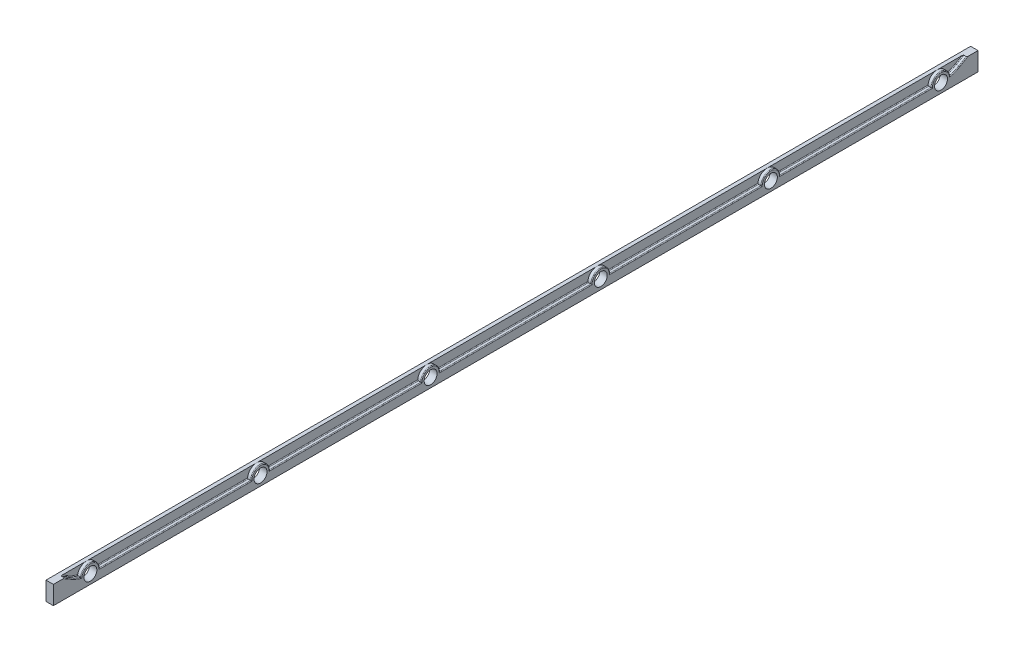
SolidWorks part; units mm, degrees
ref_plane "Front Plane" through (0, 0, 0) normal (0, 0, 1) x (1, 0, 0)
ref_plane "Top Plane" through (0, 0, 0) normal (0, 1, 0) x (1, 0, 0)
ref_plane "Right Plane" through (0, 0, 0) normal (1, 0, 0) x (0, 0, -1)
ref_plane "Plane1" through (1, 0, 0) normal (1, 0, 0) x (0, 0, -1)
sketch "Sketch1" plane through (1, 0, 0) normal (1, 0, 0) x (0, 0, -1)
  line L0 (125, -2.5) -> (125, 2.5)
  line L1 (125, 2.5) -> (-125, 2.5)
  line L2 (-125, 2.5) -> (-125, -2.5)
  line L3 (-125, -2.5) -> (125, -2.5)
extrude "Boss-Extrude1" add sketch "Sketch1" against normal blind 2
sketch "Sketch2" plane through (1, 0, 0) normal (1, 0, 0) x (0, 0, -1)
  line L0 (119.9904, 1.3397) -> (122, 2.5)
  line L1 (122, 2.5) -> (115, 2.5)
  arc A0 (115, 2.5) -> (117.4801, 0.3149) centre (115, 0) cw
  arc A1 (117.4801, 0.3149) -> (119.9904, 1.3397) centre (114.9904, 10) ccw
extrude "Cut-Extrude1" cut sketch "Sketch2" against normal blind 1
sketch "Sketch3" plane through (1, 0, 0) normal (1, 0, 0) x (0, 0, -1)
  line L0 (115, 2.5) -> (69, 2.5)
  line L1 (71.5, 0) -> (112.5, 0)
  arc A0 (112.5, 0) -> (115, 2.5) centre (115, 0) cw
  arc A1 (69, 2.5) -> (71.5, 0) centre (69, 0) cw
extrude "Cut-Extrude2" cut sketch "Sketch3" against normal blind 1
sketch "Sketch4" plane through (1, 0, 0) normal (1, 0, 0) x (0, 0, -1)
  line L0 (69, 2.5) -> (23, 2.5)
  line L1 (25.5, 0) -> (66.5, 0)
  arc A0 (66.5, 0) -> (69, 2.5) centre (69, 0) cw
  arc A1 (23, 2.5) -> (25.5, 0) centre (23, 0) cw
extrude "Cut-Extrude3" cut sketch "Sketch4" against normal blind 1
sketch "Sketch5" plane through (1, 0, 0) normal (1, 0, 0) x (0, 0, -1)
  line L0 (23, 2.5) -> (-23, 2.5)
  line L1 (-20.5, 0) -> (20.5, 0)
  arc A0 (20.5, 0) -> (23, 2.5) centre (23, 0) cw
  arc A1 (-23, 2.5) -> (-20.5, 0) centre (-23, 0) cw
extrude "Cut-Extrude4" cut sketch "Sketch5" against normal blind 1
sketch "Sketch6" plane through (1, 0, 0) normal (1, 0, 0) x (0, 0, -1)
  line L0 (-23, 2.5) -> (-69, 2.5)
  line L1 (-66.5, 0) -> (-25.5, 0)
  arc A0 (-25.5, 0) -> (-23, 2.5) centre (-23, 0) cw
  arc A1 (-69, 2.5) -> (-66.5, 0) centre (-69, 0) cw
extrude "Cut-Extrude5" cut sketch "Sketch6" against normal blind 1
sketch "Sketch7" plane through (1, 0, 0) normal (1, 0, 0) x (0, 0, -1)
  line L0 (-69, 2.5) -> (-115, 2.5)
  line L1 (-112.5, 0) -> (-71.5, 0)
  arc A0 (-71.5, 0) -> (-69, 2.5) centre (-69, 0) cw
  arc A1 (-115, 2.5) -> (-112.5, 0) centre (-115, 0) cw
extrude "Cut-Extrude6" cut sketch "Sketch7" against normal blind 1
sketch "Sketch8" plane through (1, 0, 0) normal (1, 0, 0) x (0, 0, -1)
  line L0 (-115, 2.5) -> (-122, 2.5)
  line L1 (-122, 2.5) -> (-119.9904, 1.3397)
  arc A0 (-117.4801, 0.3149) -> (-115, 2.5) centre (-115, 0) cw
  arc A1 (-119.9904, 1.3397) -> (-117.4801, 0.3149) centre (-114.9904, 10) ccw
extrude "Cut-Extrude7" cut sketch "Sketch8" against normal blind 1
hole_wizard "Ø3.5 (3.5) Diameter Hole1" positions "Sketch10" profile "Sketch9" hole size "Ø3.5" standard "ANSI Metric"
sketch "Sketch10" plane through (1, 0, 0) normal (1, 0, 0) x (0, 0, -1)
  point P0 (-69, 0)
  point P1 (-23, 0)
  point P2 (23, 0)
  point P3 (69, 0)
  point P4 (115, 0)
  point P5 (-115, 0)
sketch "Sketch9" plane through (1, 0, 69) normal (0, 1, 0) x (0, 0, -1)
  line L0 (0, 0) -> (0, 2)
  line L1 (0, 2) -> (1.75, 2)
  line L2 (1.75, 2) -> (1.75, 0)
  line L5 (1.75, 0) -> (0, 0)
  line L11 (0, -6.35) -> (0, 107.95) construction
  dimension "Thru Hole Dia." = 3.5
  dimension "Thru Hole Depth" = 2
fillet "Fillet1" radius 0.2 24 edges at (1, 1.9199, -120.9952) (1, 0.7418, -118.7701) (1, 2.495, -114.8422) (1, 0, -92) (1, 2.5, -69) (1, 0, -46) (1, 2.5, -23) (1, 0, 0) (1, 1.9199, 120.9952) (1, 0.7418, 118.7701) (1, 2.5, 23) (1, 2.495, 114.8422) (1, 0, 46) (1, 0, 92) (1, 2.5, 69) (0, 0.7418, -118.7701) (0, 1.9199, -120.9952) (0, 0, -92) (0, 0, -46) (0, 0, 0) (0, 0, 46) (0, 0, 92) (0, 0.7418, 118.7701) (0, 1.9199, 120.9952)
